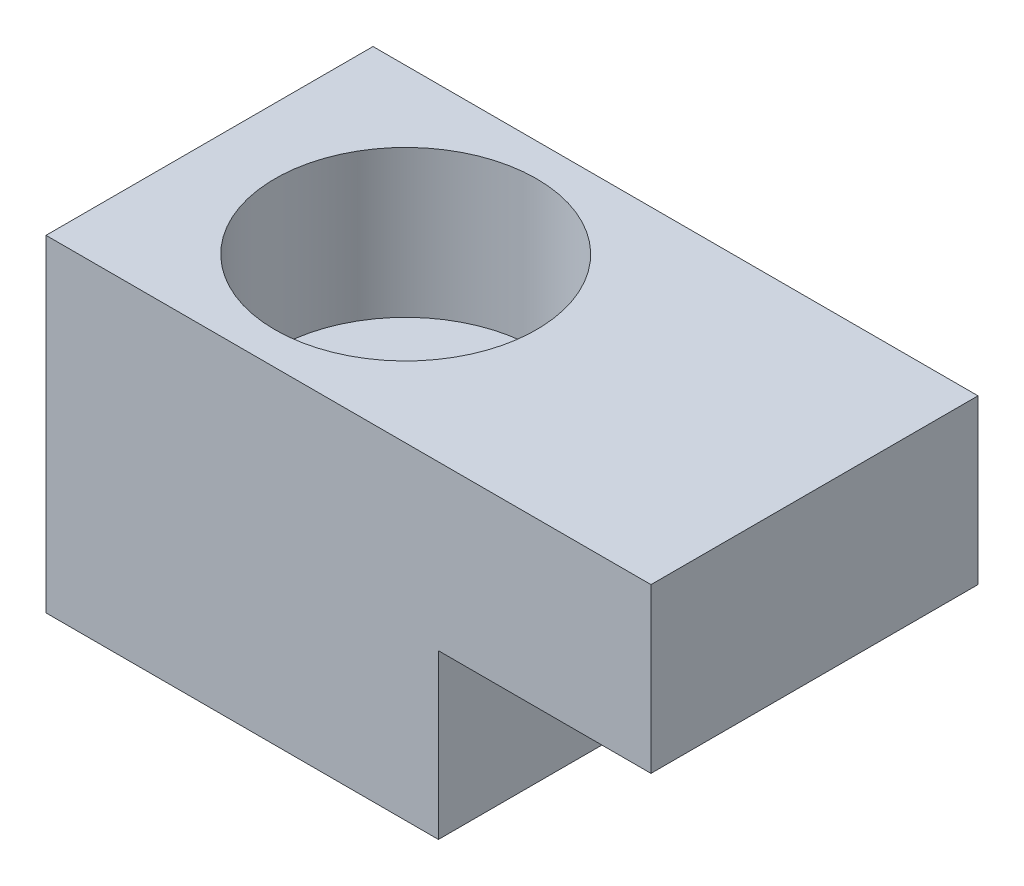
SolidWorks part; units mm, degrees
ref_plane "前视基准面" through (0, 0, 0) normal (0, 0, 1) x (1, 0, 0)
ref_plane "上视基准面" through (0, 0, 0) normal (0, 1, 0) x (1, 0, 0)
ref_plane "右视基准面" through (0, 0, 0) normal (1, 0, 0) x (0, 0, -1)
sketch "草图1" plane through (0, 0, 0) normal (0, 0, 1) x (1, 0, 0)
  line L0 (0, 0) -> (0, 10)
  line L1 (18.5, 5) -> (18.5, 10)
  line L2 (12, 0) -> (12, 5)
  line L3 (0, 0) -> (12, 0)
  line L4 (12, 5) -> (18.5, 5)
  line L5 (0, 10) -> (18.5, 10)
extrude "凸台-拉伸1" add sketch "草图1" along normal blind 10
sketch "草图2" plane through (0, 10, 0) normal (0, 1, 0) x (1, 0, 0)
  circle A0 centre (6, -5) radius 2.25
extrude "切除-拉伸1" cut sketch "草图2" against normal blind 10
sketch "草图3" plane through (0, 10, 0) normal (0, 1, 0) x (1, 0, 0)
  circle A0 centre (6, -5) radius 4
extrude "切除-拉伸2" cut sketch "草图3" against normal blind 4.5
sketch "草图4" plane through (0, 10, 0) normal (0, 1, 0) x (1, 0, 0)
  circle A0 centre (15.25, -5) radius 2.1 construction
sketch "草图5" plane through (0, 5, 0) normal (0, -1, 0) x (1, 0, 0)
  circle A0 centre (15.25, 5) radius 2.1
extrude "切除-拉伸3" cut sketch "草图5" against normal blind 3
